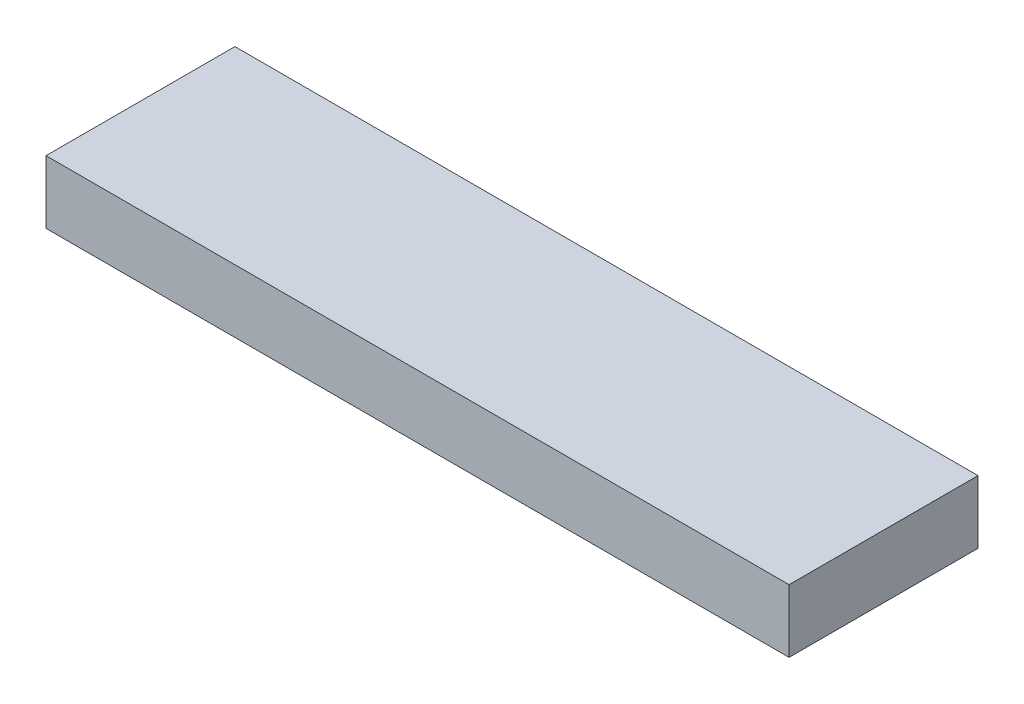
SolidWorks part; units mm, degrees
ref_plane "Plan de face" through (0, 0, 0) normal (0, 0, 1) x (1, 0, 0)
ref_plane "Plan de dessus" through (0, 0, 0) normal (0, 1, 0) x (1, 0, 0)
ref_plane "Plan de droite" through (0, 0, 0) normal (1, 0, 0) x (0, 0, -1)
ref_plane "Plan4" through (0, -10, 0) normal (0, -1, 0) x (1, 0, 0)
sketch "Esquisse1" plane through (0, -10, 0) normal (0, -1, 0) x (1, 0, 0)
  line L0 (118, -30) -> (118, 30)
  line L1 (118, 30) -> (-118, 30)
  line L2 (-118, 30) -> (-118, -30)
  line L3 (-118, -30) -> (118, -30)
  dimension "D1" = 236
  dimension "D2" = 60
  dimension "D3" = 30
  dimension "D4" = 118
extrude "Boss.-Extru.1" add sketch "Esquisse1" against normal blind 20
